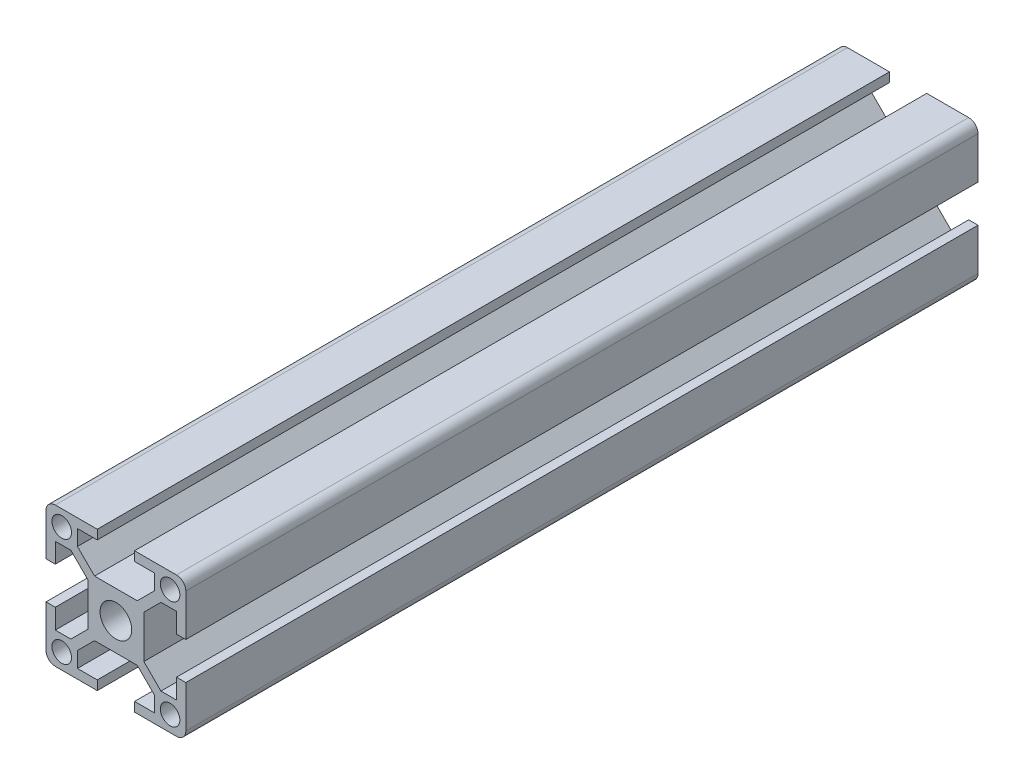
SolidWorks part; units mm, degrees
ref_plane "前视基准面" through (0, 0, 0) normal (0, 0, 1) x (1, 0, 0)
ref_plane "上视基准面" through (0, 0, 0) normal (0, 1, 0) x (1, 0, 0)
ref_plane "右视基准面" through (0, 0, 0) normal (1, 0, 0) x (0, 0, -1)
sketch "草图1" plane through (0, 0, 0) normal (0, 0, 1) x (1, 0, 0)
  line L0 (-15, -4) -> (-15, -13)
  line L1 (-13, 15) -> (-4, 15)
  line L2 (-15, 13) -> (-15, 4)
  line L3 (-13, -15) -> (-4, -15)
  line L4 (15, 13) -> (15, 4)
  line L5 (-15, 15) -> (15, -15) construction
  line L6 (-15, -15) -> (15, 15) construction
  line L7 (-8.25, 13) -> (-4, 13)
  line L8 (-8.25, 9.6642) -> (-8.25, 13)
  line L9 (-4.5858, 6) -> (-8.25, 9.6642)
  line L10 (6, 4.5858) -> (6, -4.5858)
  line L11 (-6, 6) -> (6, -6) construction
  line L12 (-6, -6) -> (6, 6) construction
  line L13 (4, 15) -> (13, 15)
  line L14 (4.5858, -6) -> (8.25, -9.6642)
  line L15 (-4.5858, -6) -> (4.5858, -6)
  line L16 (0, 0) -> (19.2057, 0) construction
  line L17 (-4.5858, 6) -> (4.5858, 6)
  line L18 (6, 4.5858) -> (9.6642, 8.25)
  line L19 (13, 8.25) -> (13, 4)
  line L20 (4.5858, 6) -> (8.25, 9.6642)
  line L21 (8.25, 9.6642) -> (8.25, 13)
  line L22 (15, -4) -> (15, -13)
  line L23 (4, 13) -> (8.25, 13)
  line L24 (4, 13) -> (4, 15)
  line L25 (-4, 13) -> (-4, 15)
  line L26 (6, -4.5858) -> (9.6642, -8.25)
  line L27 (13, -4) -> (13, -8.25)
  line L28 (13, -4) -> (15, -4)
  line L29 (13, 4) -> (15, 4)
  line L30 (9.6642, -8.25) -> (13, -8.25)
  line L31 (-4.5858, -6) -> (-8.25, -9.6642)
  line L32 (-4, -13) -> (-4, -15)
  line L33 (9.6642, 8.25) -> (13, 8.25)
  line L34 (-8.25, -9.6642) -> (-8.25, -13)
  line L35 (-13, -8.25) -> (-13, -4)
  line L36 (-9.6642, -8.25) -> (-13, -8.25)
  line L37 (-6, -4.5858) -> (-9.6642, -8.25)
  line L38 (-6, -4.5858) -> (-6, 4.5858)
  line L39 (-6, 4.5858) -> (-9.6642, 8.25)
  line L40 (-9.6642, 8.25) -> (-13, 8.25)
  line L41 (-13, 4) -> (-13, 8.25)
  line L42 (-13, 4) -> (-15, 4)
  line L43 (-13, -4) -> (-15, -4)
  line L44 (0, 0) -> (6, 4.5858) construction
  line L45 (0, 0) -> (-4.5858, 6) construction
  line L46 (-8.25, -13) -> (-4, -13)
  line L47 (4, -13) -> (4, -15)
  line L48 (4, -13) -> (8.25, -13)
  line L49 (8.25, -9.6642) -> (8.25, -13)
  line L50 (4, -15) -> (13, -15)
  circle A0 centre (0, 0) radius 36.5532 construction
  circle A1 centre (11.625, 11.625) radius 2.1
  circle A2 centre (-11.625, 11.625) radius 2.1
  circle A3 centre (-11.625, -11.625) radius 2.1
  circle A4 centre (11.625, -11.625) radius 2.1
  circle A5 centre (0, 0) radius 3.4
  arc A6 (-15, -13) -> (-13, -15) centre (-13, -13) ccw
  arc A7 (13, -15) -> (15, -13) centre (13, -13) ccw
  arc A8 (13, 15) -> (15, 13) centre (13, 13) cw
  arc A9 (-13, 15) -> (-15, 13) centre (-13, 13) ccw
  point P0 (0, 0)
  point P6 (0, 0)
  point P11 (-14.2929, -15.7071)
  point P12 (15.7071, 14.2929)
  point P15 (-15.7071, -13.725)
  point P16 (14.2929, 15.7071)
  point P17 (-14.2929, 15.7071)
  point P18 (15.7071, -14.2929)
  point P21 (0, -8.25)
  point P22 (19.2057, -8.25)
  point P23 (0, 8.25)
  point P24 (19.2057, 8.25)
  point P27 (0, -4)
  point P28 (19.2057, -4)
  point P29 (0, 4)
  point P30 (19.2057, 4)
  point P72 (-8.25, -9.6642)
  point P74 (8.25, -9.6642)
  dimension "D7" = 4.2
  dimension "D8" = 4.2
  dimension "D10" = 3.375
  dimension "D17" = 6.8
  dimension "D18" = 2
  dimension "D1" = 30
  dimension "D2" = 30
  dimension "D3" = 3
  dimension "D4" = 6.75
  dimension "D9" = 2
  dimension "D5" = 6.75
  dimension "D6" = 3.375
extrude "凸台-拉伸1" add sketch "草图1" along normal blind 170
